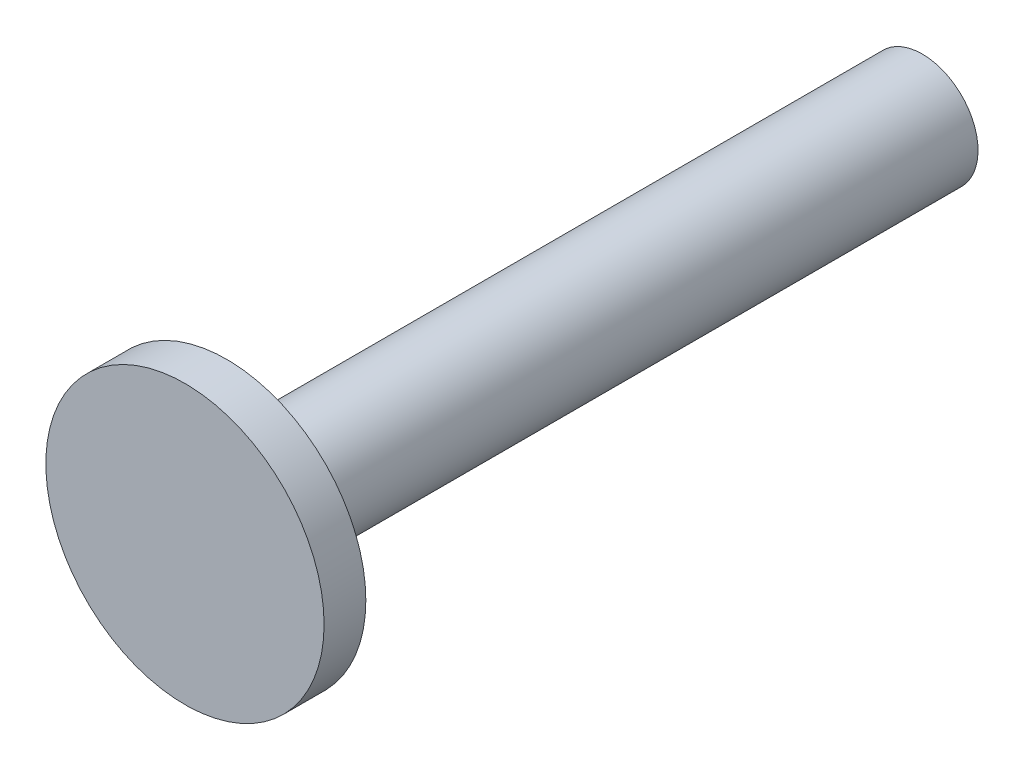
SolidWorks part; units mm, degrees
ref_plane "Front Plane" through (0, 0, 0) normal (0, 0, 1) x (1, 0, 0)
ref_plane "Top Plane" through (0, 0, 0) normal (0, 1, 0) x (1, 0, 0)
ref_plane "Right Plane" through (0, 0, 0) normal (1, 0, 0) x (0, 0, -1)
sketch "Sketch1" plane through (0, 0, 0) normal (0, 0, 1) x (1, 0, 0)
  circle A2 centre (20, -24.7474) radius 10
  circle A3 centre (20, -24.7474) radius 10
  dimension "D1" = 5
extrude "Boss-Extrude1" add sketch "Sketch1" along normal blind 3
sketch "Sketch2" plane through (0, 0, 0) normal (0, 0, -1) x (-1, 0, 0)
  circle A4 centre (-20, -24.7474) radius 4
  circle A5 centre (-20, -24.7474) radius 4
  dimension "D1" = 1
extrude "Boss-Extrude2" add sketch "Sketch2" along normal offset from surface (50 mm away) 3
